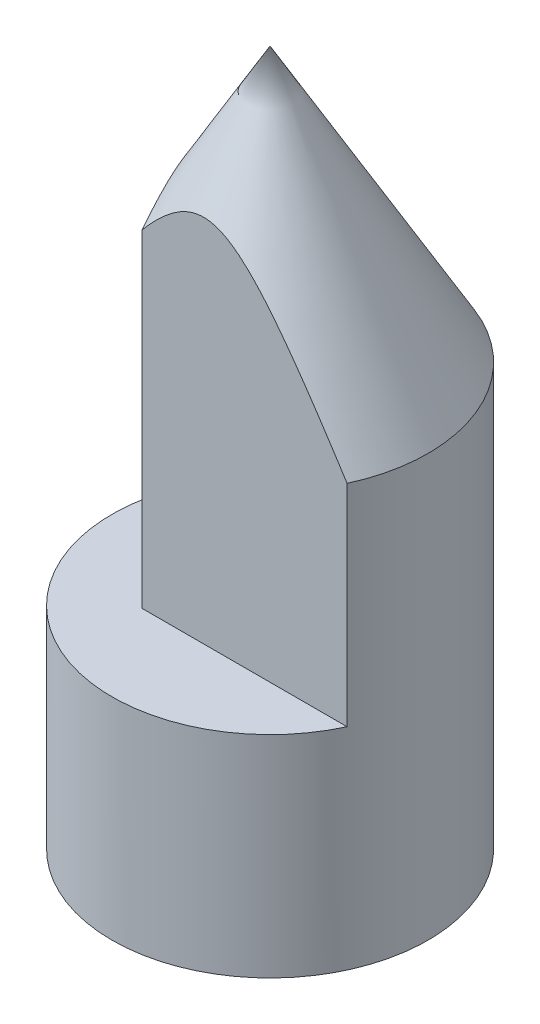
SolidWorks part; units mm, degrees
ref_plane "前视基准面" through (0, 0, 0) normal (0, 0, 1) x (1, 0, 0)
ref_plane "上视基准面" through (0, 0, 0) normal (0, 1, 0) x (1, 0, 0)
ref_plane "右视基准面" through (0, 0, 0) normal (1, 0, 0) x (0, 0, -1)
sketch "草图1" plane through (0, 0, 0) normal (0, 1, 0) x (1, 0, 0)
  line L0 (-57.3368, 0) -> (64.8074, 0) construction
  line L1 (0, 75.4529) -> (0, -62.3794) construction
  circle A0 centre (0, 0) radius 15
  dimension "D1" = 30
extrude "拉伸1" add sketch "草图1" along normal blind 40
sketch "草图2" plane through (0, 0, 0) normal (0, 0, 1) x (1, 0, 0)
  line L0 (0, 0) -> (0, 65.9808) construction
  line L1 (0, 65.9808) -> (-15, 40)
  line L2 (15, 40) -> (-15, 40) construction
  line L3 (-15, 40) -> (0, 40)
  line L4 (0, 65.9808) -> (0, 40)
  dimension "D1" = 30
  dimension "D2" = 15
revolve "旋转1" add sketch "草图2" angle 360 about L0
ref_plane "基准面1" through (0, 20, 0) normal (0, 1, 0) x (-1, 0, 0)
sketch "草图3" plane through (0, 20, 0) normal (0, 1, 0) x (-1, 0, 0)
  line L1 (-22.6227, 6.3031) -> (13.0363, 6.3031)
  line L2 (-22.6227, 6.3031) -> (-22.6227, 15.3031)
  line L3 (-22.6227, 15.3031) -> (13.0363, 15.3031)
  line L4 (13.0363, 6.3031) -> (13.0363, 15.3031)
  line L5 (5.8507, -13.5755) -> (23.9982, -13.5755)
  line L6 (5.8507, -13.5755) -> (5.8507, 15.0346)
  line L7 (5.8507, 15.0346) -> (23.9982, 15.0346)
  line L8 (23.9982, -13.5755) -> (23.9982, 15.0346)
  dimension "D1" = 9
extrude "切除-拉伸2" cut sketch "草图3" along normal blind 48
